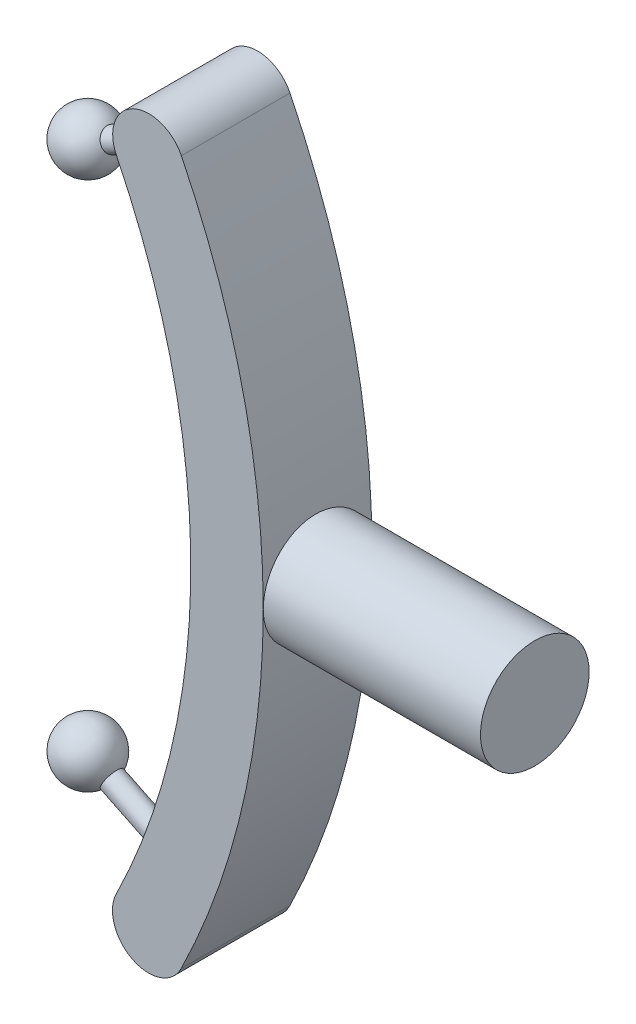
SolidWorks part; units mm, degrees
ref_plane "Plane1" through (0, 0, 0) normal (0, 0, 1) x (1, 0, 0)
ref_plane "Plane2" through (0, 0, 0) normal (0, 1, 0) x (1, 0, 0)
ref_plane "Plane3" through (0, 0, 0) normal (1, 0, 0) x (0, 0, -1)
sketch "Sketch2" plane through (0, 0, 0) normal (0, 0, 1) x (1, 0, 0)
  arc A10 (113.9094, -56.1574) -> (113.9444, 56.0864) centre (0, 0) ccw
  arc A11 (113.9094, -56.1574) -> (125.3003, -61.7731) centre (119.6048, -58.9653) ccw
  arc A12 (125.3003, -61.7731) -> (139.7, -0.0435) centre (0, 0) ccw
  arc A13 (139.7, -0.0435) -> (125.3388, 61.695) centre (0, 0) ccw
  arc A14 (125.3388, 61.695) -> (113.9444, 56.0864) centre (119.6416, 58.8907) ccw
  dimension "D1" = 127
  dimension "D2" = 139.7
  dimension "D3" = 6.35
  dimension "D4" = 58.9653
  dimension "D5" = 119.6048
extrude "Base-Extrude" add sketch "Sketch2" along normal mid plane 19.05
sketch "Sketch4" plane through (0, 0, 0) normal (0, 0, 1) x (1, 0, 0)
  line L0 (177.8, 0) -> (133.35, 0) construction
  line L1 (133.35, 0) -> (177.8, 0)
  line L2 (133.35, 0) -> (133.35, 9.525)
  line L3 (133.35, 9.525) -> (177.8, 9.525)
  line L4 (177.8, 0) -> (177.8, 9.525)
  arc A0 (113.9094, -56.1574) -> (113.9444, 56.0864) centre (0, 0) ccw construction
  point P7 (0, 0)
  dimension "D1" = 133.35
  dimension "D2" = 177.8
  dimension "D3" = 9.525
revolve "Boss-Revolve2" add sketch "Sketch4" angle 360 about L0
sketch "Sketch3" plane through (0, 0, 0) normal (0, 0, 1) x (1, 0, 0)
  line L0 (99.4091, 46.4859) -> (120.6437, 56.8345)
  line L2 (119.8091, 58.5469) -> (98.5746, 48.1984)
  line L3 (119.8091, 58.5469) -> (120.6437, 56.8345)
  line L4 (99.4091, 46.4859) -> (98.5746, 48.1984)
  line L5 (120.6437, 56.8345) -> (99.4091, 46.4859) construction
  arc A0 (125.3388, 61.695) -> (113.9444, 56.0864) centre (119.6416, 58.8907) ccw construction
  point P0 (119.6416, 58.8907)
  dimension "D1" = 1.905
  dimension "D2" = 0.3824
  dimension "D3" = 23.622
revolve "Boss-Revolve1" add sketch "Sketch3" angle 360 about L5
sketch "Sketch5" plane through (0, 0, 0) normal (0, 0, 1) x (1, 0, 0)
  line L0 (98.5746, 48.1984) -> (100.2437, 44.7734) construction
  line L1 (99.4091, 46.4859) -> (112.8181, 53.0207) construction
  line L2 (120.6437, 56.8345) -> (99.4091, 46.4859) construction
  line L3 (94.8426, 44.2604) -> (103.7122, 48.583)
  line L4 (103.7122, 48.583) -> (103.9757, 48.7114)
  arc A0 (103.9757, 48.7114) -> (94.8426, 44.2604) centre (99.4091, 46.4859) ccw
  point P0 (99.4091, 46.4859)
  dimension "D1" = 5.08
revolve "Boss-Revolve3" add sketch "Sketch5" angle 360 about L1
mirror "Mirror1" about plane through (0, 0, 0) normal (0, 1, 0) of "Boss-Revolve1", "Boss-Revolve3"
